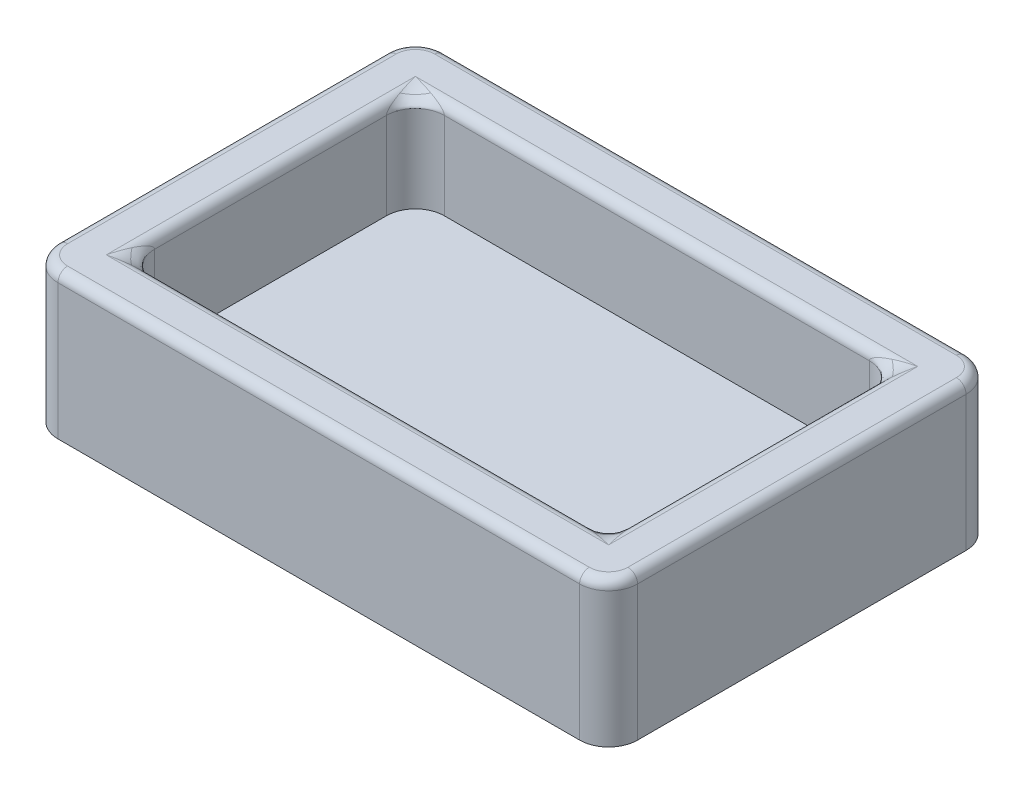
SolidWorks part; units mm, degrees
ref_plane "Front Plane" through (0, 0, 0) normal (0, 0, 1) x (1, 0, 0)
ref_plane "Top Plane" through (0, 0, 0) normal (0, 1, 0) x (1, 0, 0)
ref_plane "Right Plane" through (0, 0, 0) normal (1, 0, 0) x (0, 0, -1)
sketch "Sketch1"
  dimension "D1" = 152.4
  dimension "D2" = 101.6
extrude "Extrude1" add sketch "Sketch1" along normal blind 38.1
sketch "Sketch3"
  dimension "D1" = 76.2
  dimension "D2" = 127
extrude "Extrude2" cut sketch "Sketch3" against normal blind 25.4
fillet "Fillet1" radius 2.54 8 edges at (0, 38.1, -50.8) (76.2, 38.1, 0) (0, 38.1, 50.8) (-76.2, 38.1, 0) (0, 38.1, 38.1) (63.5, 38.1, 0) (0, 38.1, -38.1) (-63.5, 38.1, 0)
fillet "Fillet2" radius 7.62 16 edges at (-75.4561, 37.3561, -50.0561) (75.4561, 37.3561, -50.0561) (75.4561, 37.3561, 50.0561) (-75.4561, 37.3561, 50.0561) (-64.2439, 37.3561, -38.8439) (64.2439, 37.3561, 38.8439) (-64.2439, 37.3561, 38.8439) (64.2439, 37.3561, -38.8439) (-63.5, 24.13, -38.1) (63.5, 24.13, 38.1) (-63.5, 24.13, 38.1) (63.5, 24.13, -38.1) (-76.2, 17.78, 50.8) (76.2, 17.78, 50.8) (76.2, 17.78, -50.8) (-76.2, 17.78, -50.8)
